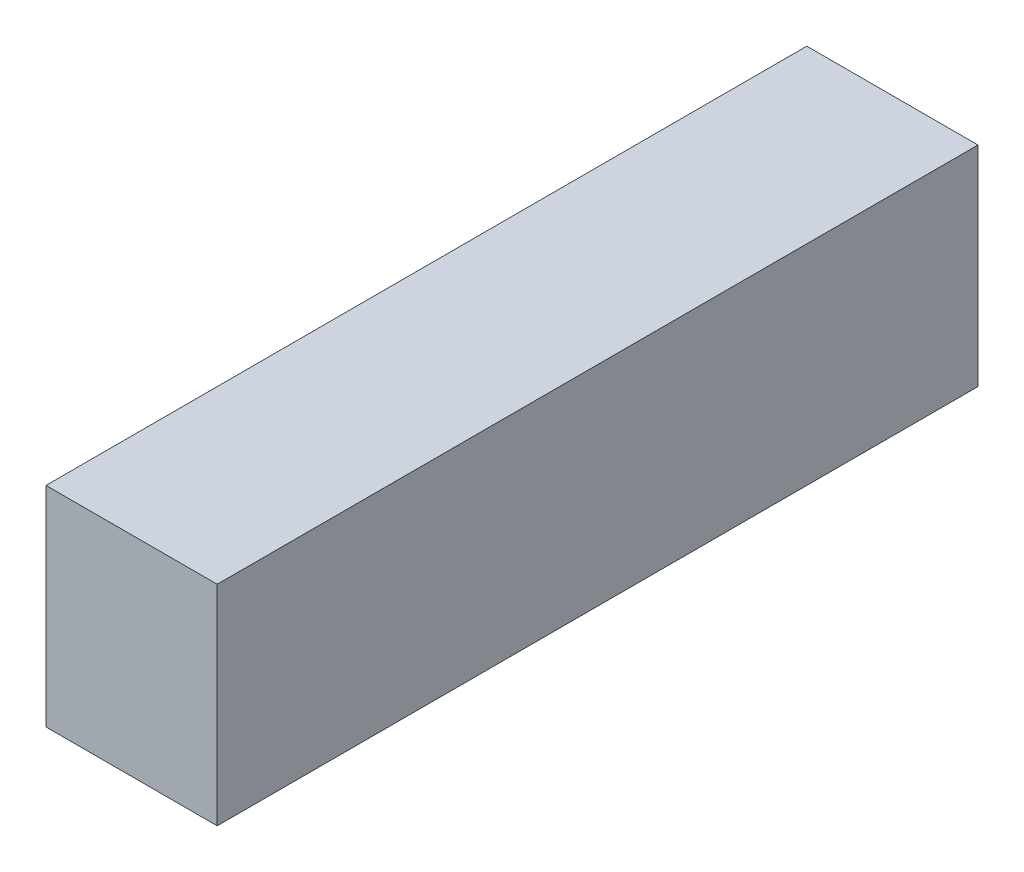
SolidWorks part; units mm, degrees
ref_plane "Front Plane" through (0, 0, 0) normal (0, 0, 1) x (1, 0, 0)
ref_plane "Top Plane" through (0, 0, 0) normal (0, 1, 0) x (1, 0, 0)
ref_plane "Right Plane" through (0, 0, 0) normal (1, 0, 0) x (0, 0, -1)
sketch "Sketch1" plane through (0, 0, 0) normal (0, 0, 1) x (1, 0, 0)
  line L1 (0, 0) -> (114.3, 0)
  line L2 (0, 0) -> (0, 139.7)
  line L3 (0, 139.7) -> (114.3, 139.7)
  line L4 (114.3, 0) -> (114.3, 139.7)
  line L5 (0, 0) -> (114.3, 139.7) construction
  line L6 (0, 139.7) -> (114.3, 0) construction
  point P4 (57.15, 69.85)
  dimension "D1" = 114.3
  dimension "D2" = 139.7
extrude "Boss-Extrude1" add sketch "Sketch1" along normal blind 508
equation "\"system_width\"= 7ft + 10 "
equation "\"system_length\"= 95.5"
equation "\"module_board_length\"= 11.25in"
equation "\"module_board_width\"= 1.5in"
equation "\"module_width\"= (\"system_width\" -  2* \"module_trim_thickness\") / 2"
equation "\"module_board_short_depth\"= \"module_width\" - ( 2 * \"module_board_width\" ) - \"module_lip_width\""
equation "\"module_board_hole\"= 0.5in"
equation "\"module_board_hole_seperation\"= 20in"
equation "\"system_step_width\"= 3ft"
equation "\"system_top_length\"= \"system_length\" - \"system_step_length\""
equation "\"module_top_thickness\"= 0.75in"
equation "\"module_lip_width\"= 1.5in"
equation "\"module_trim_thickness\"= 1in"
equation "\"module_trim_height\"= 14in"
equation "\"module_top_overhang\"= 4.5in"
equation "\"module_trim_angle\"= 45deg"
equation "\"module_length\"= (\"system_top_length\" - \"module_trim_thickness\")/ 2"
equation "\"module_board_long_depth\"= \"module_length\" - \"module_lip_width\""
equation "\"module_board_hole_position\"= ( ( \"module_width\" - \"module_board_hole_seperation\" ) / 2 ) + \"module_board_width\"/2"
equation "\"D1@Boss-Extrude1\"=(\"module_width\" - 4*\"module_board_width\")/2"
equation "\"step_board_length\"= 5.5in"
equation "\"step_board_width\"= 1.5in"
equation "\"system_step_length\"= 2ft+11.5"
equation "\"step_module_width\"= \"module_width\""
equation "\"step_module_length\"= \"system_step_length\" - \"module_trim_thickness\""
equation "\"step_board_long_depth\"= \"step_module_width\" - (2 * \"module_board_width\") - \"module_lip_width\""
equation "\"step_board_short_depth\"= \"step_module_length\" - \"module_lip_width\""
equation "\"step_trim_height\"= 8in"
